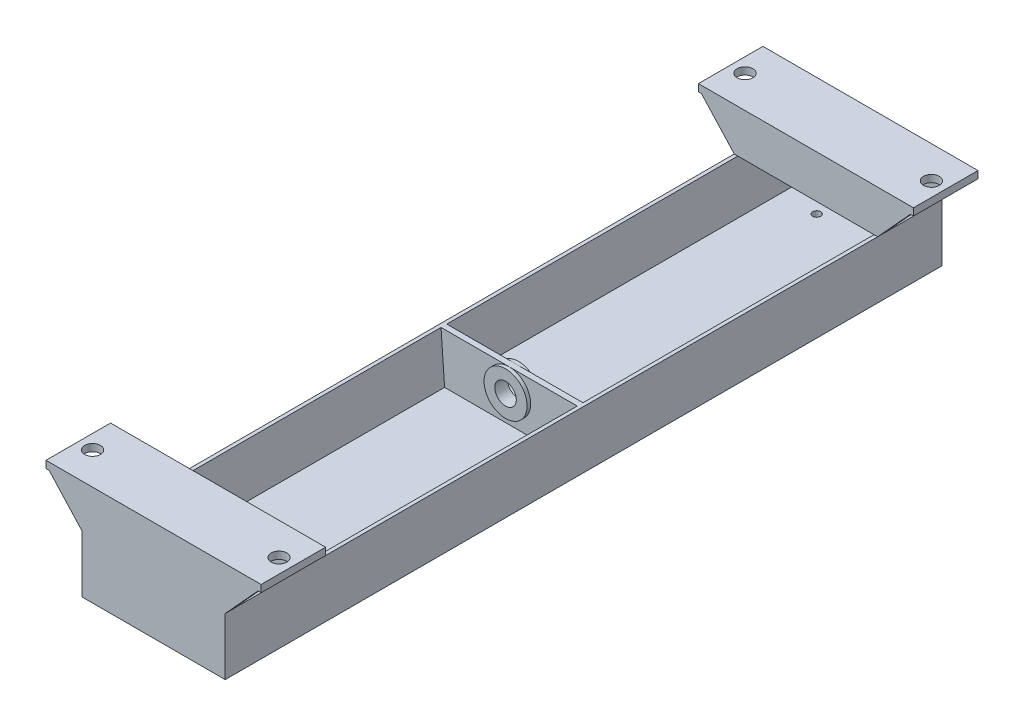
SolidWorks part; units mm, degrees
ref_plane "Front" through (0, 0, 0) normal (0, 0, 1) x (1, 0, 0)
ref_plane "Top" through (0, 0, 0) normal (0, 1, 0) x (1, 0, 0)
ref_plane "Right" through (0, 0, 0) normal (1, 0, 0) x (0, 0, -1)
sketch "Sketch1" plane through (0, 0, 0) normal (0, 0, 1) x (1, 0, 0)
  line L0 (0, 25.3095) -> (0, -33.746) construction
  line L1 (-33.6456, 0) -> (33.043, 0) construction
  line L2 (-63.5, 50.8) -> (-63.5, 0)
  line L3 (-63.5, 50.8) -> (-60.325, 50.8)
  line L4 (-60.325, 50.8) -> (-57.15, 6.35)
  line L5 (-63.5, 0) -> (63.5, 0)
  line L6 (-57.15, 6.35) -> (57.15, 6.35)
  line L7 (60.325, 50.8) -> (57.15, 6.35)
  line L8 (63.5, 50.8) -> (60.325, 50.8)
  line L9 (63.5, 50.8) -> (63.5, 0)
  point P12 (0, 6.35)
  point P13 (0, 0)
  dimension "D1" = 50.8
  dimension "D2" = 6.35
  dimension "D3" = 127
  dimension "D4" = 3.175
  dimension "D5" = 6.35
extrude "Extrude1" add sketch "Sketch1" along normal mid plane 635
sketch "Sketch2" plane through (0, 0, 0) normal (0, 1, 0) x (-1, 0, 0)
  line L0 (-63.5, -317.5) -> (-82.55, -317.5)
  line L1 (-52.7739, -304.8) -> (-35.5069, -304.8) construction
  line L2 (-63.5, -292.1) -> (-82.55, -292.1)
  line L3 (-63.5, -317.5) -> (-63.5, -292.1)
  arc A0 (-82.55, -292.1) -> (-82.55, -317.5) centre (-82.55, -304.8) ccw
  circle A1 centre (-82.55, -304.8) radius 4.3688
  dimension "D1" = 25.4
  dimension "D2" = 19.05
  dimension "D3" = 8.7376
extrude "Extrude2" add sketch "Sketch2" along normal blind 6.35
sketch "Sketch3" plane through (0, 0, -215.9) normal (0, 0, -1) x (-1, 0, 0)
  line L0 (-25.4, 0) -> (-28.575, 0)
  line L1 (-28.575, 0) -> (-50.7391, 3.175)
  line L2 (-50.7391, 3.175) -> (-50.7391, 6.35)
  line L3 (-44.45, 6.35) -> (-25.4, 6.35) construction
  line L4 (-50.7391, 6.35) -> (-25.4, 6.35)
  line L5 (-25.4, 6.35) -> (-25.4, 0)
  dimension "D1" = 3.175
  dimension "D2" = 3.175
extrude "Extrude3" add sketch "Sketch3" against normal blind 3.175
ref_point "Point1"
ref_plane "Plane1" through (0, 0, -203.2) normal (0, 0, 1) x (1, 0, 0)
mirror "Mirror1" about plane through (0, 0, -203.2) normal (0, 0, 1)
mirror "Mirror2" about plane through (0, 0, 0) normal (1, 0, 0)
mirror "Mirror3" about plane through (0, 0, 0) normal (0, 0, 1)
sketch "Sketch4" plane through (0, 6.35, 0) normal (0, 1, 0) x (-1, 0, 0)
  line L0 (-15.7795, -238.9118) -> (-19.05, -215.9)
  line L1 (-22.225, -215.9) -> (-19.05, -215.9) construction
  line L2 (0, 0) -> (0, -299.2135) construction
  line L3 (15.7795, -238.9118) -> (19.05, -215.9)
  line L4 (-19.05, -215.9) -> (19.05, -215.9)
  arc A0 (-15.7795, -238.9118) -> (15.7795, -238.9118) centre (0, -236.6692) ccw
sketch "Sketch5" plane through (0, 0, -215.9) normal (0, 0, -1) x (-1, 0, 0)
  line L0 (0, 34.9277) -> (0, -8.6354) construction
  line L1 (-25.4, 50.8) -> (-25.4, 0)
  line L2 (-25.4, 0) -> (25.4, 0)
  line L3 (-25.4, 50.8) -> (-22.225, 50.8)
  line L4 (-22.225, 50.8) -> (-19.05, 6.35)
  line L5 (-15.7795, 6.35) -> (-19.05, 6.35) construction
  line L6 (-19.05, 6.35) -> (19.05, 6.35)
  line L7 (22.225, 50.8) -> (19.05, 6.35)
  line L8 (25.4, 50.8) -> (22.225, 50.8)
  line L9 (25.4, 50.8) -> (25.4, 0)
  point P15 (0, 6.35)
  point P18 (0, 0)
extrude "Extrude4" add sketch "Sketch5" along normal blind 25.4
mirror "Mirror4" about plane through (0, 0, 0) normal (0, 0, 1)
sketch "Sketch6" plane through (0, 6.35, 0) normal (0, 1, 0) x (-1, 0, 0)
  line L0 (-84.5496, 0) -> (79.8524, 0) construction
  line L1 (0, 0) -> (0, -299.2135) construction
  circle A0 centre (0, -228.6) radius 6.35
  dimension "D1" = 12.0785
  dimension "D2" = 228.6
extrude "Cut-Extrude1" cut sketch "Sketch6" against normal through all
mirror "Mirror5" about plane through (0, 0, 0) normal (0, 0, 1)
sketch "Sketch7" plane through (0, 0, -215.9) normal (0, 0, -1) x (-1, 0, 0)
  line L0 (0, 36.6549) -> (0, -9.0721) construction
  line L1 (-50.7391, 6.35) -> (-50.7391, 92.397)
  line L3 (50.7391, 6.35) -> (50.7391, 92.397)
  line L4 (22.225, 50.8) -> (25.4, 50.8) construction
  line L5 (-50.7391, 6.35) -> (50.7391, 6.35)
  line L6 (-19.05, 6.35) -> (19.05, 6.35) construction
  line L7 (-50.7391, 6.35) -> (-50.7391, 3.175) construction
  arc A0 (50.7391, 92.397) -> (-50.7391, 92.397) centre (0, 92.397) ccw
  dimension "D1" = 41.597
extrude "Extrude5" add sketch "Sketch7" against normal blind 12.7
sketch "Sketch8" plane through (0, 0, -317.5) normal (0, 0, -1) x (-1, 0, 0)
  line L0 (63.5, 0) -> (-63.5, 0) construction
  line L1 (0, 0) -> (0, 38.5723) construction
  circle A0 centre (0, 114.2037) radius 7.0772
  circle A1 centre (0, 63.5) radius 7.0772
  dimension "D1" = 14.1544
  dimension "D2" = 50.7037
  dimension "D3" = 63.5
extrude "Cut-Extrude2" cut sketch "Sketch8" against normal blind 12.7
mirror "Mirror6" about plane through (0, 0, 0) normal (0, 0, 1)
sketch "Sketch9" plane through (0, 0, 0) normal (0, 0, 1) x (1, 0, 0)
  line L0 (-60.325, 50.8) -> (60.325, 50.8)
  line L1 (60.325, 50.8) -> (57.15, 6.35)
  line L2 (57.15, 6.35) -> (-57.15, 6.35)
  line L3 (-57.15, 6.35) -> (-60.325, 50.8)
extrude "Extrude6" add sketch "Sketch9" along normal mid plane 5.08
sketch "Sketch10" plane through (0, 0, 2.54) normal (0, 0, 1) x (1, 0, 0)
  line L0 (0, 0) -> (0, 61.8921) construction
  line L1 (57.15, 6.35) -> (-57.15, 6.35) construction
  circle A0 centre (0, 31.75) radius 9.525
  dimension "D1" = 19.05
  dimension "D2" = 25.4
extrude "Cut-Extrude3" cut sketch "Sketch10" against normal through all
sketch "Sketch11" plane through (63.5, 0, 0) normal (1, 0, 0) x (0, 0, -1)
  line L0 (-266.7, 50.8) -> (-266.7, 0)
  line L1 (-317.5, 50.8) -> (317.5, 50.8) construction
  line L2 (-317.5, 0) -> (317.5, 0) construction
  line L3 (-266.7, 0) -> (-215.9, 0)
  line L4 (-215.9, 0) -> (-215.9, 50.8)
  line L5 (-215.9, 50.8) -> (-222.25, 50.8)
  line L6 (-222.25, 50.8) -> (-222.25, 6.35)
  line L7 (-317.5, 6.35) -> (-2.54, 6.35) construction
  line L8 (-222.25, 6.35) -> (-260.35, 6.35)
  line L9 (-260.35, 6.35) -> (-260.35, 50.8)
  line L10 (-260.35, 50.8) -> (-266.7, 50.8)
  line L11 (-317.5, 0) -> (-317.5, 50.8) construction
  line L12 (0, 0) -> (0, 122.8691) construction
  line L13 (260.35, 50.8) -> (266.7, 50.8)
  line L14 (260.35, 6.35) -> (260.35, 50.8)
  line L15 (222.25, 6.35) -> (260.35, 6.35)
  line L16 (222.25, 50.8) -> (222.25, 6.35)
  line L17 (215.9, 50.8) -> (222.25, 50.8)
  line L18 (215.9, 0) -> (215.9, 50.8)
  line L19 (266.7, 0) -> (215.9, 0)
  line L20 (266.7, 50.8) -> (266.7, 0)
  dimension "D1" = 6.35
  dimension "D2" = 6.35
  dimension "D3" = 50.8
  dimension "D4" = 50.8
extrude "Extrude7" add sketch "Sketch11" along normal blind 50.8
mirror "Mirror7" about plane through (0, 0, 0) normal (1, 0, 0)
sketch "Sketch13" plane through (0, 0, 0) normal (1, 0, 0) x (0, 0, -1)
  line L0 (-317.5, 50.8) -> (317.5, 50.8) construction
  line L1 (-29.7516, 50.8) -> (24.391, 50.8)
  line L2 (-29.7516, 50.8) -> (-29.7516, 25.9361)
  line L3 (-29.7516, 25.9361) -> (24.391, 25.9361)
  line L4 (24.391, 50.8) -> (24.391, 25.9361)
extrude "Cut-Extrude5" cut sketch "Sketch13" against normal through all and the other way through all
sketch "Sketch14" plane through (0, 0, 2.54) normal (0, 0, 1) x (1, 0, 0)
  circle A0 centre (0, 31.75) radius 9.525
  circle A1 centre (0, 31.75) radius 19.05
  circle A2 centre (0, 31.75) radius 9.525 construction
  dimension "D1" = 38.1
extrude "Extrude8" add sketch "Sketch14" along normal blind 3.175
mirror "Mirror8" about plane through (0, 0, 0) normal (0, 0, 1) of "Extrude8"
sketch "Sketch15" plane through (0, 0, 0) normal (0, -1, 0) x (1, 0, 0)
  line L0 (-90.8618, 0) -> (123.4206, 0) construction
  line L1 (0, 236.9978) -> (0, -265.7707) construction
  line L2 (0, -5.715) -> (0, 5.715) construction
  circle A0 centre (-25.4, 295.275) radius 3.556
  circle A1 centre (25.4, 295.275) radius 3.556
  circle A2 centre (25.4, -295.275) radius 3.556
  circle A3 centre (-25.4, -295.275) radius 3.556
  dimension "D1" = 7.112
  dimension "D2" = 50.8
  dimension "D3" = 590.55
extrude "Cut-Extrude6" cut sketch "Sketch15" against normal through all
sketch "Sketch16" plane through (0, 0, -317.5) normal (0, 0, -1) x (-1, 0, 0)
  line L0 (60.325, 50.8) -> (57.15, 6.35)
  line L1 (57.15, 6.35) -> (-57.15, 6.35)
  line L2 (-57.15, 6.35) -> (-60.325, 50.8)
  line L3 (-60.325, 50.8) -> (60.325, 50.8)
extrude "Extrude9" add sketch "Sketch16" against normal blind 6.35
mirror "Mirror9" about plane through (0, 0, 0) normal (0, 0, 1) of "Extrude9"
sketch "Sketch17" plane through (0, 0, 317.5) normal (0, 0, 1) x (1, 0, 0)
  line L0 (0, 61.5952) -> (0, -33.1872) construction
  line L1 (-63.5, 50.8) -> (-95.25, 85.5611)
  line L2 (-95.25, 85.5611) -> (-95.25, 88.9)
  line L3 (-95.25, 88.9) -> (95.25, 88.9)
  line L4 (95.25, 85.5611) -> (95.25, 88.9)
  line L5 (95.25, 85.5611) -> (63.5, 50.8)
  line L6 (-63.5, 50.8) -> (63.5, 50.8)
  line L7 (63.5, 50.8) -> (-63.5, 50.8) construction
  point P9 (0, 88.9)
  dimension "D1" = 190.5
  dimension "D2" = 38.1
extrude "Extrude10" add sketch "Sketch17" against normal blind 6.35
pattern_linear "LPattern1" count 2 spacing 50.8 along (0, 0, -1) of "Extrude10"
sketch "Sketch18" plane through (95.25, 0, 0) normal (1, 0, 0) x (0, 0, -1)
  line L0 (-260.35, 85.5611) -> (-266.7, 85.5611) construction
  line L1 (-317.5, 88.9) -> (-260.35, 88.9)
  line L2 (-317.5, 88.9) -> (-317.5, 85.5611)
  line L3 (-317.5, 85.5611) -> (-260.35, 85.5611)
  line L4 (-260.35, 88.9) -> (-260.35, 85.5611)
extrude "Extrude11" add sketch "Sketch18" against normal blind 6.35
mirror "Mirror10" about plane through (0, 0, 0) normal (1, 0, 0) of "Extrude11"
mirror "Mirror11" about plane through (0, 0, 0) normal (0, 0, 1) of "Mirror10", "Extrude11", "LPattern1", "Extrude10"
sketch "Sketch19" plane through (0, 88.9, 0) normal (0, 1, 0) x (-1, 0, 0)
  line L1 (-95.25, -260.35) -> (95.25, -260.35)
  line L2 (-95.25, -260.35) -> (-95.25, -317.5)
  line L3 (-95.25, -317.5) -> (95.25, -317.5)
  line L4 (95.25, -260.35) -> (95.25, -317.5)
extrude "Extrude12" add sketch "Sketch19" against normal blind 6.35
mirror "Mirror12" about plane through (0, 0, 0) normal (0, 0, 1) of "Extrude12"
sketch "Sketch20" plane through (0, 88.9, 0) normal (0, 1, 0) x (-1, 0, 0)
  line L0 (44.5084, -288.925) -> (95.25, -288.925) construction
  line L2 (95.25, -260.35) -> (95.25, -317.5) construction
  circle A0 centre (82.55, -288.925) radius 6.985
  dimension "D1" = 13.97
  dimension "D2" = 12.7
extrude "Cut-Extrude7" cut sketch "Sketch20" against normal through all
mirror "Mirror13" about plane through (0, 0, 0) normal (1, 0, 0) of "Cut-Extrude7"
mirror "Mirror14" about plane through (0, 0, 0) normal (0, 0, 1) of "Mirror13", "Cut-Extrude7"
